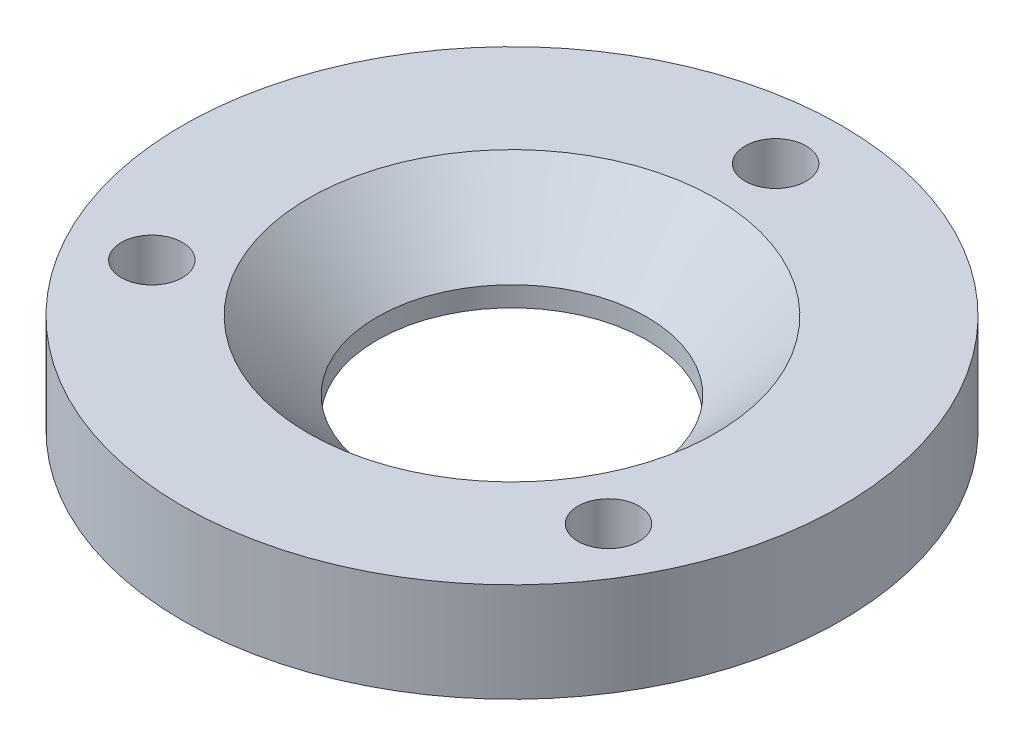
SolidWorks part; units mm, degrees
ref_plane "Front" through (0, 0, 0) normal (0, 0, 1) x (1, 0, 0)
ref_plane "Top" through (0, 0, 0) normal (0, 1, 0) x (1, 0, 0)
ref_plane "Right" through (0, 0, 0) normal (1, 0, 0) x (0, 0, -1)
sketch "Sketch1" plane through (0, 0, 0) normal (1, 0, 0) x (0, 0, -1)
  line L0 (0, 13.9108) -> (0, -13.8076) construction
  line L1 (-9.8044, 0) -> (-15.875, 0)
  line L2 (-15.875, 0) -> (-15.875, -4.7752)
  line L3 (-15.875, -4.7752) -> (-10.16, -4.7752)
  line L4 (-10.16, -4.7752) -> (-10.16, -4.2672)
  line L5 (-10.16, -4.2672) -> (-6.5024, -4.2672)
  line L6 (-6.5024, -4.2672) -> (-6.5024, -3.302)
  line L7 (-6.5024, -3.302) -> (-9.8044, 0)
  dimension "D1" = 13.0048
  dimension "D2" = 19.6088
  dimension "D3" = 20.32
  dimension "D4" = 0.508
  dimension "D5" = 135
  dimension "D6" = 4.7752
  dimension "D7" = 31.75
revolve "Revolve1" add sketch "Sketch1" angle 360 about L0
sketch "Sketch2" plane through (0, 0, 0) normal (0, 1, 0) x (-1, 0, 0)
  line L0 (0, 0) -> (0, -19.8284) construction
  circle A0 centre (0, 0) radius 12.7 construction
  circle A1 centre (0, -12.7) radius 1.4732
  dimension "D1" = 2.9464
  dimension "D2" = 25.4
extrude "Cut-Extrude1" cut sketch "Sketch2" against normal through all
pattern_circular "CirPattern1" count 3 over 360 about axis through (0, 0, 0) along (0, 1, 0) of "Cut-Extrude1"
